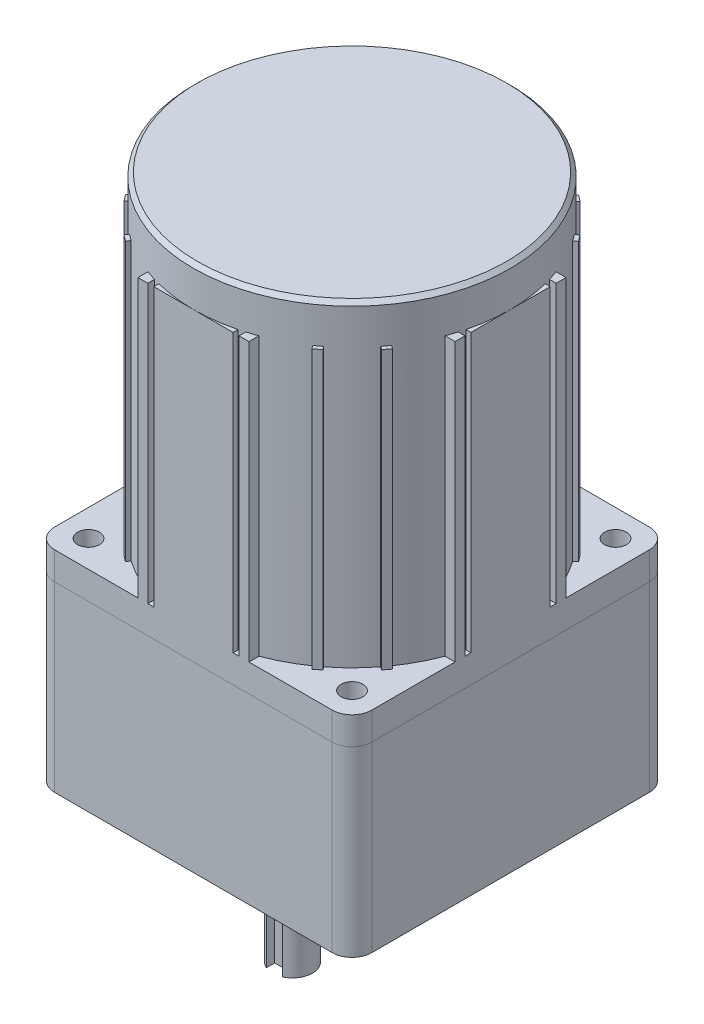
SolidWorks part; units mm, degrees
ref_plane "Front Plane" through (0, 0, 0) normal (0, 0, 1) x (1, 0, 0)
ref_plane "Top Plane" through (0, 0, 0) normal (0, 1, 0) x (1, 0, 0)
ref_plane "Right Plane" through (0, 0, 0) normal (1, 0, 0) x (0, 0, -1)
sketch "Sketch1" plane through (0, 0, 0) normal (0, 1, 0) x (1, 0, 0)
  line L1 (0, 0) -> (80, 0)
  line L2 (0, 0) -> (0, -80)
  line L3 (0, -80) -> (80, -80)
  line L4 (80, 0) -> (80, -80)
  dimension "D1" = 80
  dimension "D2" = 80
extrude "Boss-Extrude1" add sketch "Sketch1" along normal blind 87
sketch "Sketch2" plane through (0, 87, 0) normal (0, 1, 0) x (1, 0, 0)
  line L0 (40, 0) -> (40, -80) construction
  line L1 (80, 0) -> (0, 0) construction
  line L2 (0, -80) -> (80, -80) construction
  line L3 (40, -80) -> (0, -40) construction
  line L4 (0, 0) -> (0, -80) construction
  line L5 (0, -40) -> (80, -40) construction
  line L6 (80, -80) -> (80, 0) construction
  circle A0 centre (40, -40) radius 40
  dimension "D1" = 80
extrude "Cut-Extrude1" cut sketch "Sketch2" against normal blind 10 flip side to cut
sketch "Sketch4" plane through (0, 0, 0) normal (0, -1, 0) x (1, 0, 0)
  line L0 (80, 0) -> (0, 0) construction
  line L1 (80, 80) -> (80, 0) construction
  line L2 (40, 0) -> (40, 80) construction
  line L3 (0, 80) -> (80, 80) construction
  line L4 (40, 80) -> (80, 40) construction
  line L5 (80, 40) -> (0, 40) construction
  line L6 (0, 0) -> (0, 80) construction
  line L7 (40, 40) -> (64.7487, 15.2513) construction
  line L8 (40, 40) -> (94.5399, 40) construction
  circle A5 centre (40, 40) radius 35 construction
  circle A6 centre (64.7487, 15.2513) radius 2.25
  circle A7 centre (15.2513, 15.2513) radius 2.25
  circle A8 centre (15.2513, 64.7487) radius 2.25
  circle A9 centre (64.7487, 64.7487) radius 2.25
  dimension "D1" = 70
  dimension "D2" = 4.5
  dimension "D3" = 45
extrude "Cut-Extrude2" cut sketch "Sketch4" against normal blind 20
sketch "Sketch5" plane through (0, 0, 0) normal (0, -1, 0) x (-1, 0, 0)
  line L1 (0, -80) -> (-80, -80)
  line L2 (0, -80) -> (0, 0)
  line L3 (0, 0) -> (-80, 0)
  line L4 (-80, -80) -> (-80, 0)
extrude "Boss-Extrude2" add sketch "Sketch5" along normal blind 46 separate body
sketch "Sketch6" plane through (0, -46, 0) normal (0, -1, 0) x (1, 0, 0)
  line L0 (0, 40) -> (80, 40) construction
  line L1 (0, 80) -> (0, 0) construction
  line L2 (80, 0) -> (80, 80) construction
  line L3 (40, 40) -> (-22.9854, 40) construction
  line L4 (80, 80) -> (0, 80) construction
  line L5 (40, 80) -> (40, 0) construction
  line L6 (0, 0) -> (80, 0) construction
  line L7 (40, 40) -> (6.766, 73.234) construction
  circle A11 centre (40, 40) radius 47 construction
  circle A12 centre (6.766, 73.234) radius 2.75
  circle A13 centre (6.766, 6.766) radius 2.75
  circle A14 centre (73.234, 73.234) radius 2.75
  circle A15 centre (73.234, 6.766) radius 2.75
  dimension "D1" = 94
  dimension "D2" = 5.5
  dimension "D3" = 45
extrude "Cut-Extrude3" cut sketch "Sketch6" against normal through all
sketch "Sketch7" plane through (0, -46, 0) normal (0, -1, 0) x (1, 0, 0)
  circle A0 centre (40, 40) radius 36.5
  dimension "D3" = 73
  dimension "D1" = 40
  dimension "D2" = 40
extrude "Cut-Extrude4" cut sketch "Sketch7" against normal blind 2
sketch "Sketch8" plane through (0, -44, 0) normal (0, -1, 0) x (1, 0, 0)
  line L0 (80, 0) -> (80, 80) construction
  line L2 (0, 40) -> (80, 40) construction
  circle A0 centre (40, 55) radius 17
  circle A1 centre (40, 40) radius 36.5 construction
  dimension "D3" = 34
  dimension "D1" = 15
  dimension "D2" = 40
extrude "Boss-Extrude3" add sketch "Sketch8" along normal blind 5
sketch "Sketch9" plane through (0, -49, 0) normal (0, -1, 0) x (-1, 0, 0)
  circle A0 centre (-40, -55) radius 5
  dimension "D1" = 10
extrude "Boss-Extrude4" add sketch "Sketch9" along normal blind 29
sketch "Sketch10" plane through (0, -78, 0) normal (0, -1, 0) x (-1, 0, 0)
  line L6 (0, -80) -> (0, 0) construction
  line L7 (-38, -61.5) -> (-42, -61.5)
  line L8 (-38, -61.5) -> (-38, -57.5)
  line L9 (-38, -57.5) -> (-42, -57.5)
  line L10 (-42, -61.5) -> (-42, -57.5)
  circle A0 centre (-40, -55) radius 5 construction
  circle A1 centre (-40, -55) radius 5 construction
  point P0 (-35, -55)
  point P1 (-40, -60)
  point P11 (-38, -59.5)
  dimension "D1" = 2.5
  dimension "D2" = 4
  dimension "D3" = 38
  dimension "D4" = 4
  dimension "D5" = 60
extrude "Cut-Extrude5" [suppressed] cut sketch "Sketch10" against normal blind 25
fillet "Fillet1" radius 5 4 edges at (80, -23, 0) (0, -23, 0) (0, -23, 80) (80, -23, 80)
chamfer "Chamfer1" distance 1 angle 45 1 edges at (40, 87, 80)
sketch "Sketch11" plane through (0, 77, 0) normal (0, 1, 0) x (1, 0, 0)
  line L0 (0, -40) -> (0, -30)
  line L1 (0, 0) -> (0, -40) construction
  line L2 (0, -30) -> (1.2702, -30)
  line L3 (1.6888, -28.5) -> (0, -28.5)
  line L4 (0, -28.5) -> (0, -26)
  line L5 (0, -26) -> (2.53, -26)
  line L6 (40, 0) -> (30, 0)
  line L7 (30, 0) -> (30, -1.2702)
  line L8 (28.5, -1.6888) -> (28.5, 0)
  line L9 (40, 0) -> (0, 0) construction
  line L10 (28.5, 0) -> (26, 0)
  line L11 (26, 0) -> (26, -2.53)
  line L12 (8.3261, -15.5712) -> (7.5343, -14.9605)
  line L13 (7.5343, -14.9605) -> (6.3128, -16.5442)
  line L14 (6.3128, -16.5442) -> (7.1735, -17.1435)
  line L15 (15.5072, -8.3756) -> (14.8948, -7.585)
  line L16 (14.8948, -7.585) -> (16.476, -6.3604)
  line L17 (16.476, -6.3604) -> (17.0771, -7.2198)
  circle A0 centre (40, -40) radius 40 construction
  circle A1 centre (40, -40) radius 40 construction
  circle A2 centre (40, -40) radius 40
  dimension "D1" = 10
  dimension "D2" = 1.5
  dimension "D3" = 2.5
  dimension "D4" = 10
  dimension "D5" = 1.5
  dimension "D6" = 2.5
  dimension "D7" = 1
  dimension "D8" = 1
  dimension "D9" = 10
  dimension "D10" = 2
  dimension "D11" = 2
  dimension "D12" = 10
extrude "Cut-Extrude6" cut sketch "Sketch11" against normal offset from surface (70 mm away) 7 contours L16 L17 L11 L5 L14 L13 L12 L15 M7 M8 M6 | L3 L2 M7 M6 | L8 L7 M7 M8
ref_plane "Plane1" through (40, 0, 0) normal (1, 0, 0) x (0, 0, -1)
mirror "Mirror1" about plane through (40, 0, 0) normal (1, 0, 0) of "Cut-Extrude6"
ref_plane "Plane2" through (0, 0, 40) normal (0, 0, -1) x (-1, 0, 0)
mirror "Mirror3" about plane through (0, 0, 40) normal (0, 0, -1) of "Mirror1", "Cut-Extrude6"
fillet "Fillet3" radius 5 4 edges at (80, 3.5, 0) (0, 3.5, 0) (0, 3.5, 80) (80, 3.5, 80)
ref_plane "Plane3" through (0, 0, 60) normal (0, 0, 1) x (1, 0, 0)
sketch "Sketch12" plane through (0, 0, 60) normal (0, 0, 1) x (1, 0, 0)
  line L0 (40, -78) -> (40, -55) construction
  line L1 (35, -78) -> (45, -78) construction
  line L2 (38, -78) -> (38, -55)
  line L3 (42, -78) -> (42, -55)
  arc A0 (38, -78) -> (42, -78) centre (40, -78) ccw
  arc A1 (42, -55) -> (38, -55) centre (40, -55) ccw
  point P4 (40, -66.5)
  dimension "D1" = 4
  dimension "D2" = 23
extrude "Cut-Extrude7" cut sketch "Sketch12" against normal blind 2.5
